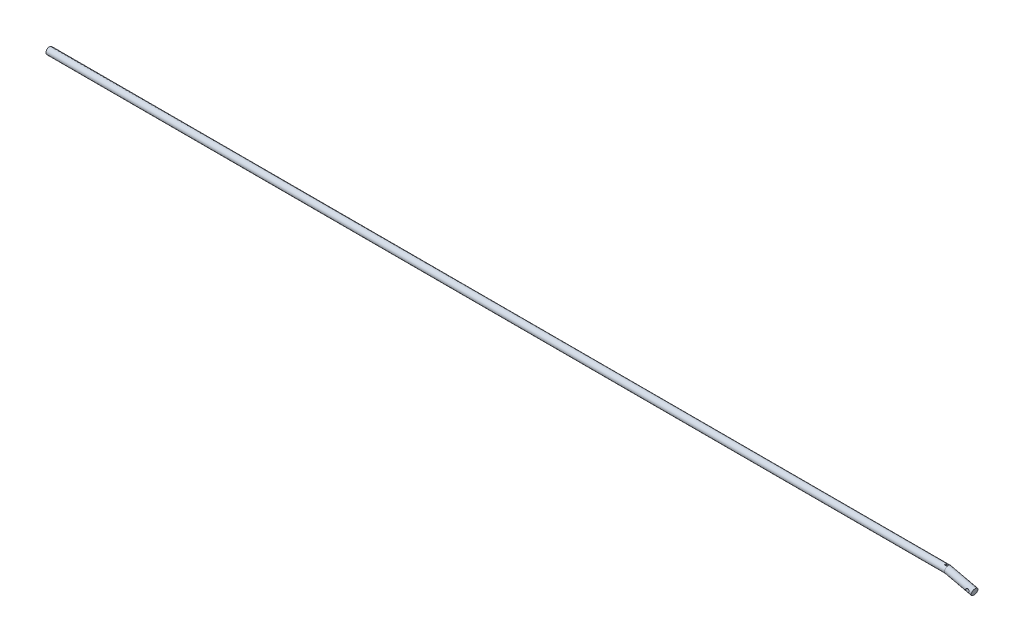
SolidWorks part; units mm, degrees
ref_plane "Front" through (0, 0, 0) normal (0, 0, 1) x (1, 0, 0)
ref_plane "Top" through (0, 0, 0) normal (0, 1, 0) x (1, 0, 0)
ref_plane "Right" through (0, 0, 0) normal (1, 0, 0) x (0, 0, -1)
sketch "Sketch1" plane through (0, 0, 0) normal (0, 0, 1) x (1, 0, 0)
  line L0 (0, 0) -> (1065.4802, 0)
  line L1 (1065.4802, 0) -> (1097.1, -7.3)
  dimension "D1" = 167
  dimension "D2" = 7.3
  dimension "D3" = 1097.1
sketch "Sketch2" plane through (0, 0, 0) normal (1, 0, 0) x (0, 0, -1)
  circle A0 centre (0, 0) radius 4
  dimension "D1" = 8
sweep "Sweep1" add profiles "Sketch2" path "Sketch1"
sketch "Sketch3" plane through (0, 0, 0) normal (0, 0, 1) x (1, 0, 0)
  line L0 (1096.2002, -11.1975) -> (1097.9998, -3.4025) construction
  line L1 (1096.2002, -11.1975) -> (1097.9998, -3.4025)
  line L2 (1097.9998, -3.4025) -> (1065.936, 4) construction
  line L3 (1097.9998, -3.4025) -> (1065.936, 4)
  line L4 (1097.1, -7.3) -> (1092.5205, -6.2427) construction
  circle A0 centre (1092.5205, -6.2427) radius 1.9
  dimension "D2" = 3.8
  dimension "D1" = 4.7
extrude "Extrude1" cut sketch "Sketch3" against normal through all and the other way through all contours A0
ref_plane "Plane1" through (0, 3.5, 0) normal (0, 1, 0) x (-1, 0, 0)
sketch "Sketch4" plane through (0, 3.5, 0) normal (0, 1, 0) x (-1, 0, 0)
  line L1 (-1065.0245, -1.2789) -> (-1062.6787, -1.2789)
  line L2 (-1065.0245, -1.2789) -> (-1065.0245, 1.2789)
  line L3 (-1065.0245, 1.2789) -> (-1062.6787, 1.2789)
  line L4 (-1062.6787, -1.2789) -> (-1062.6787, 1.2789)
  line L5 (-1065.0245, -1.2789) -> (-1062.6787, 1.2789) construction
  line L6 (-1065.0245, 1.2789) -> (-1062.6787, -1.2789) construction
  ellipse E0 centre (-1065.4802, 0) end of major axis (-1065.4802, 4) minor radius 0.4557 construction
  ellipse E1 centre (-1065.4802, 0) end of major axis (-1065.4802, 4) minor radius 0.4557
  point P11 (-1063.8516, 0)
extrude "Extrude3" cut sketch "Sketch4" against normal blind 1 and the other way blind 10 contours L1 L4 L3 L2
equation "\"rod_length\"=1100"
equation "\"D3@Sketch1\" = \"rod_length\"-2.9"
